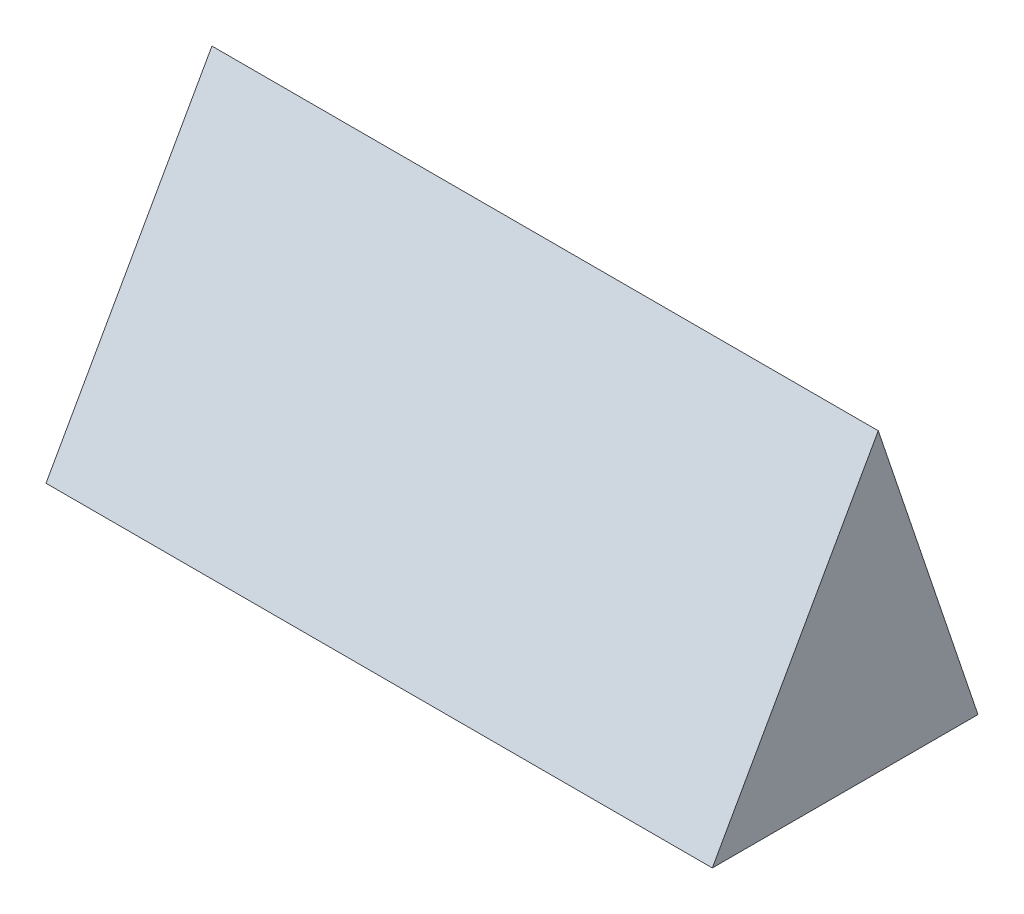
SolidWorks part; units mm, degrees
ref_plane "Front Plane" through (0, 0, 0) normal (0, 0, 1) x (1, 0, 0)
ref_plane "Top Plane" through (0, 0, 0) normal (0, 1, 0) x (1, 0, 0)
ref_plane "Right Plane" through (0, 0, 0) normal (1, 0, 0) x (0, 0, -1)
ref_plane "Plane1" through (0, 66.04, 0) normal (0, 1, 0) x (-1, 0, 0)
sketch "Sketch2" plane through (0, 0, 0) normal (0, 0, 1) x (1, 0, 0)
  line L0 (0, 26.9253) -> (148.8217, 26.9253)
sketch "Sketch3" plane through (0, 66.04, 0) normal (0, 1, 0) x (-1, 0, 0)
  line L2 (0, 0) -> (-148.8217, 0) construction
  arc A0 (0, 0) -> (-148.8217, -17.8861) centre (0, -628.0789) ccw
sketch "Sketch1" plane through (0, 0, 0) normal (1, 0, 0) x (0, 0, -1)
  line L0 (-37.0612, 0) -> (0, 66.04)
  line L1 (0, 66.04) -> (22.2764, 0)
  line L2 (22.2764, 0) -> (-37.0612, 0)
sweep "Sweep2" add profiles "Sketch1" path "Sketch2"
sketch "Sketch4" plane through (148.8217, 0, 0) normal (1, 0, 0) x (0, 0, -1)
  line L0 (0, 26.9253) -> (0, 66.04) construction
  line L1 (22.2764, 0) -> (-37.0612, 0) construction
  dimension "D1" = 270
sketch "Sketch5" plane through (0, 0, 0) normal (-1, 0, 0) x (0, 0, 1)
  line L0 (0, 26.9253) -> (0, 66.04) construction
